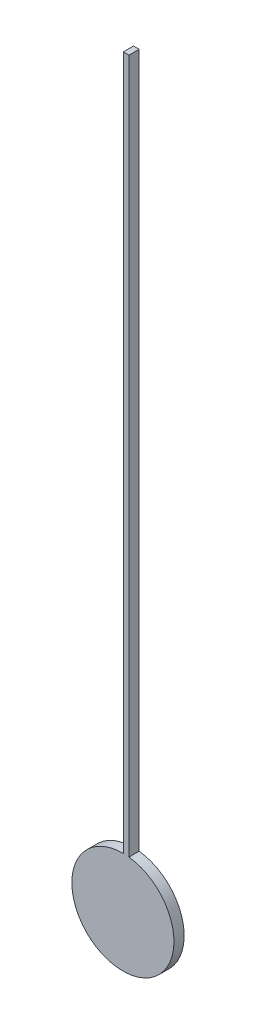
SolidWorks part; units mm, degrees
ref_plane "Ebene vorne" through (0, 0, 0) normal (0, 0, 1) x (1, 0, 0)
ref_plane "Ebene oben" through (0, 0, 0) normal (0, 1, 0) x (1, 0, 0)
ref_plane "Ebene rechts" through (0, 0, 0) normal (1, 0, 0) x (0, 0, -1)
sketch "Skizze1" plane through (0, 0, 0) normal (0, 0, 1) x (1, 0, 0)
  line L2 (0.0383, 4.9999) -> (0.0383, 72.9846)
  line L3 (0.0383, 72.9846) -> (0.5927, 72.9846)
  line L4 (0.5927, 4.9647) -> (0.5927, 72.9846)
  arc A0 (0.0383, 4.9999) -> (0.5927, 4.9647) centre (0, 0) ccw
  dimension "D1" = 10
extrude "Linear austragen1" add sketch "Skizze1" along normal blind 1
